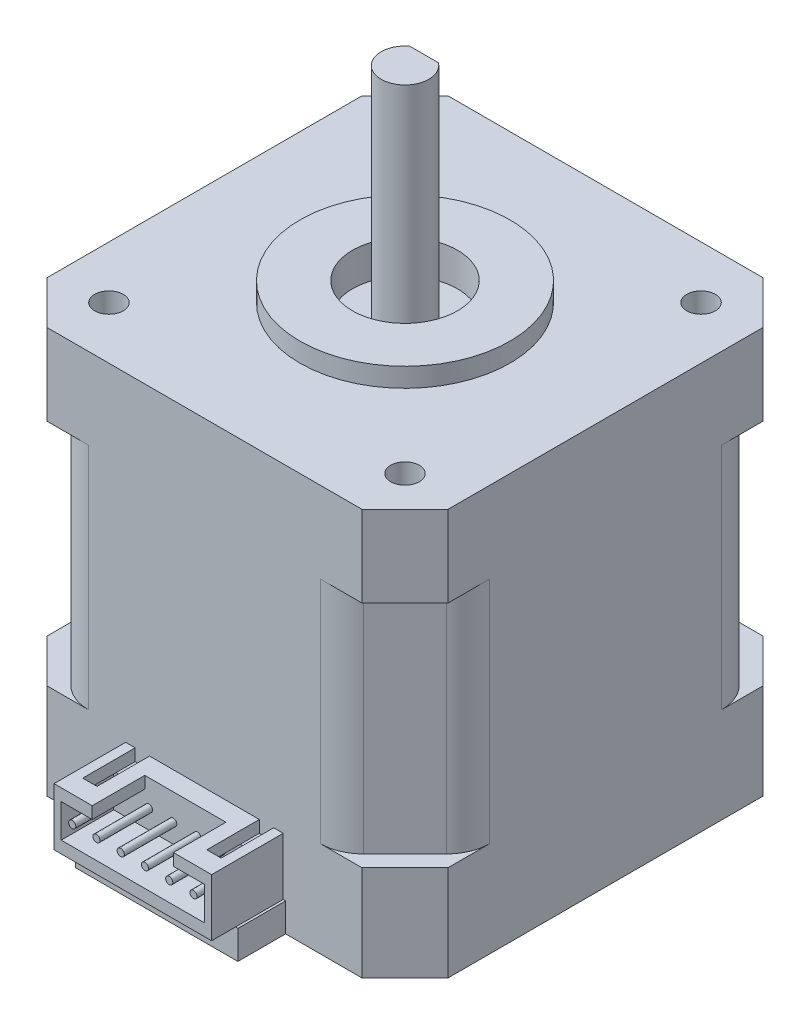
SolidWorks part; units mm, degrees
ref_plane "Front Plane" through (0, 0, 0) normal (0, 0, 1) x (1, 0, 0)
ref_plane "Top Plane" through (0, 0, 0) normal (0, 1, 0) x (1, 0, 0)
ref_plane "Right Plane" through (0, 0, 0) normal (1, 0, 0) x (0, 0, -1)
sketch "Sketch1" plane through (0, 0, 0) normal (0, 1, 0) x (1, 0, 0)
  line L0 (-21, 16.5) -> (-16.5, 21)
  line L1 (-16.5, -21) -> (16.5, -21)
  line L2 (-21, -16.5) -> (-21, 16.5)
  line L3 (-16.5, 21) -> (16.5, 21)
  line L4 (21, -16.5) -> (21, 16.5)
  line L5 (-21, -21) -> (21, 21) construction
  line L6 (-21, 21) -> (21, -21) construction
  line L7 (16.5, 21) -> (21, 16.5)
  line L8 (16.5, -21) -> (21, -16.5)
  line L9 (-21, -16.5) -> (-16.5, -21)
  point P0 (0, 0)
  dimension "D1" = 42
  dimension "D3" = 42
extrude "Boss-Extrude1" add sketch "Sketch1" along normal blind 10
sketch "Sketch2" plane through (0, 10, 0) normal (0, 1, 0) x (1, 0, 0)
  line L0 (-15.318, 19.682) -> (-19.682, 15.318)
  line L5 (12.136, -21) -> (-12.136, -21)
  line L6 (21, -12.136) -> (21, 12.136)
  line L7 (12.136, 21) -> (-12.136, 21)
  line L8 (-21, -12.136) -> (-21, 12.136)
  line L9 (21, -21) -> (-21, 21) construction
  line L10 (21, 21) -> (-21, -21) construction
  line L11 (19.682, 15.318) -> (15.318, 19.682)
  line L12 (19.682, -15.318) -> (15.318, -19.682)
  line L13 (-15.318, -19.682) -> (-19.682, -15.318)
  arc A0 (-19.682, -15.318) -> (-21, -12.136) centre (-16.5, -12.136) cw
  arc A1 (-15.318, -19.682) -> (-12.136, -21) centre (-12.136, -16.5) ccw
  arc A2 (15.318, -19.682) -> (12.136, -21) centre (12.136, -16.5) cw
  arc A3 (19.682, -15.318) -> (21, -12.136) centre (16.5, -12.136) ccw
  arc A4 (19.682, 15.318) -> (21, 12.136) centre (16.5, 12.136) cw
  arc A5 (15.318, 19.682) -> (12.136, 21) centre (12.136, 16.5) ccw
  arc A6 (-19.682, 15.318) -> (-21, 12.136) centre (-16.5, 12.136) ccw
  arc A7 (-15.318, 19.682) -> (-12.136, 21) centre (-12.136, 16.5) cw
  point P0 (0, 0)
  point P17 (-21, -14)
  point P20 (-14, -21)
  point P23 (14, -21)
  point P26 (21, -14)
  point P29 (21, 14)
  point P32 (14, 21)
  point P35 (-21, 14)
  point P38 (-14, 21)
  dimension "D3" = 4.5
  dimension "D1" = 42
  dimension "D2" = 42
extrude "Boss-Extrude3" add sketch "Sketch2" along normal blind 24
sketch "Sketch4" plane through (0, 34, 0) normal (0, 1, 0) x (1, 0, 0)
  line L0 (-16.5, 21) -> (-21, 16.5)
  line L1 (16.5, -21) -> (-16.5, -21)
  line L2 (21, -16.5) -> (21, 16.5)
  line L3 (16.5, 21) -> (-16.5, 21)
  line L4 (-21, -16.5) -> (-21, 16.5)
  line L5 (21, -21) -> (-21, 21) construction
  line L6 (21, 21) -> (-21, -21) construction
  line L7 (21, 16.5) -> (16.5, 21)
  line L8 (-16.5, -21) -> (-21, -16.5)
  line L9 (21, -16.5) -> (16.5, -21)
  point P0 (0, 0)
  dimension "D1" = 42
  dimension "D3" = 42
extrude "Boss-Extrude4" add sketch "Sketch4" along normal blind 8.5
sketch "Sketch5" plane through (0, 42.5, 0) normal (0, 1, 0) x (1, 0, 0)
  circle A0 centre (0, 0) radius 11
  dimension "D1" = 22
extrude "Boss-Extrude5" add sketch "Sketch5" along normal blind 2
sketch "Sketch6" plane through (0, 42.5, 0) normal (0, 1, 0) x (1, 0, 0)
  line L0 (0, -21) -> (0, 21) construction
  line L1 (16.5, 21) -> (-16.5, 21) construction
  line L2 (21, 0) -> (-21, 0) construction
  line L3 (-21, 16.5) -> (-21, -16.5) construction
  circle A0 centre (-15.5, 15.5) radius 1.5
  circle A2 centre (15.5, 15.5) radius 1.5
  circle A3 centre (15.5, -15.5) radius 1.5
  circle A4 centre (-15.5, -15.5) radius 1.5
  point P6 (0, 0)
  point P12 (0, 0)
  point P22 (0, 0)
  dimension "D1" = 3
  dimension "D2" = 31
  dimension "D3" = 31
  dimension "D4" = 4
extrude "Cut-Extrude1" cut sketch "Sketch6" against normal up to next
sketch "Sketch7" plane through (0, 44.5, 0) normal (0, 1, 0) x (1, 0, 0)
  circle A0 centre (0, 0) radius 5.5
  dimension "D1" = 11
extrude "Cut-Extrude2" cut sketch "Sketch7" against normal blind 3.5
sketch "Sketch8" plane through (0, 41, 0) normal (0, 1, 0) x (1, 0, 0)
  circle A0 centre (0, 0) radius 2.5
  dimension "D1" = 5
extrude "Boss-Extrude6" add sketch "Sketch8" along normal blind 3.5
sketch "Sketch9" plane through (0, 44.5, 0) normal (0, 1, 0) x (1, 0, 0)
  line L0 (0, 0) -> (0, -2.5) construction
  line L1 (-1.5, 2) -> (1.5, 2)
  circle A1 centre (0, 0) radius 2.5
  arc A2 (-1.5, 2) -> (1.5, 2) centre (0, 0) ccw
  dimension "D2" = 4.5
  dimension "D1" = 0
extrude "Boss-Extrude7" add sketch "Sketch9" along normal blind 19.5
sketch "Sketch10" plane through (0, 0, 0) normal (0, -1, 0) x (1, 0, 0)
  circle A0 centre (-15.5, 15.5) radius 3.5
  circle A1 centre (15.5, 15.5) radius 3.5
  circle A2 centre (15.5, -15.5) radius 3.5
  circle A3 centre (-15.5, -15.5) radius 3.5
  point P12 (0, 0)
  dimension "D1" = 7
  dimension "D3" = 31
  dimension "D2" = 4
extrude "Cut-Extrude3" cut sketch "Sketch10" against normal blind 3
sketch "Sketch11" plane through (0, 0, 21) normal (0, 0, 1) x (1, 0, 0)
  line L0 (8.5, 3) -> (8.5, 0)
  line L1 (8.5, 3) -> (-8.5, 3)
  line L2 (8.5, 0) -> (-8.5, 0)
  line L3 (-8.5, 3) -> (-8.5, 0)
  line L4 (8.5, 3) -> (-8.5, 0) construction
  line L5 (8.5, 0) -> (-8.5, 3) construction
  point P1 (0, 1.5)
  point P2 (0, 0)
  dimension "D1" = 3
  dimension "D2" = 17
extrude "Boss-Extrude8" add sketch "Sketch11" along normal blind 5
sketch "Sketch12" plane through (0, 0, 21) normal (0, 0, 1) x (1, 0, 0)
  line L0 (-8.25, 3) -> (8.25, 3)
  line L1 (-8.25, 3) -> (-8.25, 9)
  line L2 (8.25, 3) -> (8.25, 9)
  line L3 (-8.25, 9) -> (8.25, 9)
  line L4 (8.5, 3) -> (-8.5, 3) construction
  point P0 (0, 3)
  dimension "D1" = 6
  dimension "D2" = 16.5
extrude "Boss-Extrude9" add sketch "Sketch12" along normal blind 7.5
sketch "Sketch13" plane through (0, 0, 28.5) normal (0, 0, 1) x (1, 0, 0)
  line L1 (-7.5, 4.25) -> (7.5, 4.25)
  line L2 (-7.5, 4.25) -> (-7.5, 7.75)
  line L3 (-7.5, 7.75) -> (7.5, 7.75)
  line L4 (7.5, 4.25) -> (7.5, 7.75)
  line L5 (-7.5, 4.25) -> (7.5, 7.75) construction
  line L6 (-7.5, 7.75) -> (7.5, 4.25) construction
  point P0 (0, 6)
  dimension "D1" = 3.5
  dimension "D2" = 15
  dimension "D3" = 6
extrude "Cut-Extrude4" cut sketch "Sketch13" against normal blind 5.5
sketch "Sketch14" plane through (0, 9, 0) normal (0, 1, 0) x (1, 0, 0)
  line L0 (8.25, -28.5) -> (-8.25, -28.5) construction
  line L1 (-4.25, -28.5) -> (4.25, -28.5)
  line L2 (-4.25, -28.5) -> (-4.25, -23)
  line L3 (-4.25, -23) -> (4.25, -23)
  line L4 (4.25, -28.5) -> (4.25, -23)
  line L5 (0, -23) -> (0, -28.5) construction
  line L6 (-4.25, -25.75) -> (4.25, -25.75) construction
  line L7 (-8.25, -28.5) -> (-8.25, -21) construction
  line L8 (8.25, -28.5) -> (8.25, -21) construction
  line L10 (8.25, -21) -> (-8.25, -21) construction
  point P104 (0, -25.75)
  dimension "D1" = 4
  dimension "D2" = 4
  dimension "D3" = 2
extrude "Cut-Extrude5" cut sketch "Sketch14" against normal up to next
sketch "Sketch15" plane through (0, 9, 0) normal (0, 1, 0) x (1, 0, 0)
  line L0 (-16.5, -21) -> (16.5, -21) construction
  line L1 (-7.25, -21) -> (-5.75, -21)
  line L2 (-7.25, -21) -> (-7.25, -26.5)
  line L3 (-7.25, -26.5) -> (-5.75, -26.5)
  line L4 (-5.75, -21) -> (-5.75, -26.5)
  line L5 (-6.5, -26.5) -> (-6.5, -21) construction
  line L6 (-7.25, -23.75) -> (-5.75, -23.75) construction
  line L7 (-4.25, -23) -> (-4.25, -28.5) construction
  line L8 (-4.25, -28.5) -> (-8.25, -28.5) construction
  line L9 (0, 0) -> (0, -28.5) construction
  line L10 (-7.5, -28.5) -> (7.5, -28.5) construction
  line L11 (7.25, -26.5) -> (5.75, -26.5)
  line L12 (5.75, -21) -> (5.75, -26.5)
  line L13 (7.25, -21) -> (5.75, -21)
  line L14 (7.25, -21) -> (7.25, -26.5)
  point P168 (-6.5, -23.75)
  dimension "D1" = 1.5
  dimension "D2" = 1.5
  dimension "D3" = 2
extrude "Cut-Extrude6" cut sketch "Sketch15" against normal up to surface (1.25 mm away)
sketch "Sketch16" plane through (0, 0, 23) normal (0, 0, 1) x (1, 0, 0)
  line L0 (0, 0) -> (0, 9) construction
  line L1 (4.25, 9) -> (-4.25, 9) construction
  line L2 (-7.5, 4.25) -> (7.5, 4.25) construction
  circle A0 centre (-1.27, 6.25) radius 0.375
  circle A1 centre (1.27, 6.25) radius 0.375
  circle A2 centre (-3.81, 6.25) radius 0.375
  circle A3 centre (-6.35, 6.25) radius 0.375
  circle A4 centre (3.81, 6.25) radius 0.375
  circle A5 centre (6.35, 6.25) radius 0.375
  dimension "D1" = 0.75
  dimension "D2" = 2.54
  dimension "D3" = 2
  dimension "D4" = 3
  dimension "D5" = 3
extrude "Boss-Extrude10" add sketch "Sketch16" along normal up to surface (5.5 mm away)
